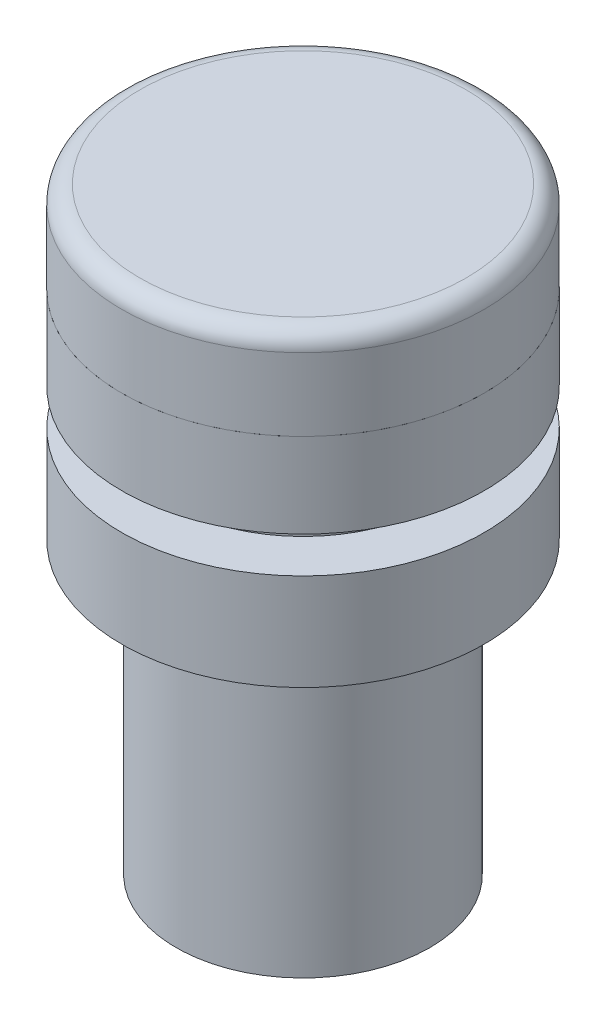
SolidWorks part; units mm, degrees
ref_plane "Plan de face" through (0, 0, 0) normal (0, 0, 1) x (1, 0, 0)
ref_plane "Plan de dessus" through (0, 0, 0) normal (0, 1, 0) x (1, 0, 0)
ref_plane "Plan de droite" through (0, 0, 0) normal (1, 0, 0) x (0, 0, -1)
sketch "Esquisse1" plane through (0, 0, 0) normal (0, 0, 1) x (1, 0, 0)
  line L0 (0, 0) -> (0, -35)
  line L1 (0, -35) -> (-10.5, -35)
  line L2 (-10.5, -35) -> (-10.5, -11)
  line L3 (-10.5, -11) -> (-15, -11)
  line L4 (-15, -11) -> (-15, -3)
  line L5 (-15, -3) -> (-11, -3)
  line L6 (-11, -3) -> (-11, 0)
  line L7 (-11, 0) -> (-15, 0)
  line L8 (-15, 0) -> (-15, 7)
  line L9 (-15, 7) -> (0, 7)
  line L10 (0, 7) -> (0, 0)
  line L12 (0, 7.1) -> (-13, 7.1)
  line L13 (0, 7.1) -> (0, 12.5)
  line L14 (0, 12.5) -> (-12.25, 12.5)
  line L15 (-13, 7.1) -> (-13, 11.75)
  arc A0 (-12.25, 12.5) -> (-13, 11.75) centre (-12.25, 11.75) ccw
  dimension "D12" = 0.75
  dimension "D1" = 7
  dimension "D2" = 15
  dimension "D3" = 11
  dimension "D4" = 3
  dimension "D5" = 15
  dimension "D6" = 8
  dimension "D7" = 42
  dimension "D8" = 10.5
  dimension "D9" = 2
  dimension "D10" = 5.5
  dimension "D11" = 0.1
revolve "Révolution1" add sketch "Esquisse1" angle 360 about L0
sketch "Esquisse2" plane through (0, 0, 0) normal (0, 0, 1) x (1, 0, 0)
  line L0 (12.25, 12.5) -> (-12.25, 12.5) construction
  line L1 (-13, 11.75) -> (-13, 7.1) construction
  line L2 (0, 12.5) -> (-12.25, 12.5)
  line L3 (-13, 11.75) -> (-13, 7.1)
  line L4 (0, 12.5) -> (0, 14.5)
  line L5 (0, 14.5) -> (-13.5, 14.5)
  line L6 (-15, 13) -> (-15, 7)
  line L7 (-15, 7) -> (-13, 7)
  line L8 (15, 7) -> (-15, 7) construction
  line L9 (-13, 7) -> (-13, 7.1)
  arc A0 (-12.25, 12.5) -> (-13, 11.75) centre (-12.25, 11.75) ccw construction
  arc A1 (-12.25, 12.5) -> (-13, 11.75) centre (-12.25, 11.75) ccw
  arc A2 (-13.5, 14.5) -> (-15, 13) centre (-13.5, 13) ccw
  dimension "D2" = 1.5
  dimension "D1" = 2
revolve "Révolution2" add sketch "Esquisse2" angle 360 about L4
